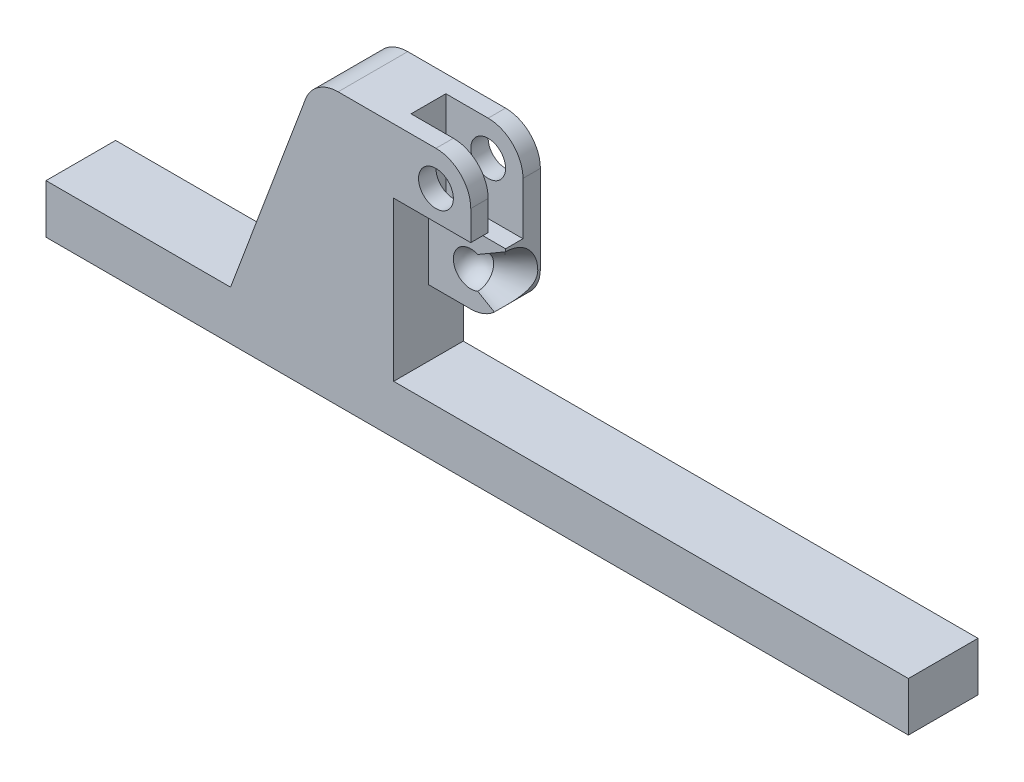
SolidWorks part; units mm, degrees
ref_plane "Plan1" through (0, 0, 0) normal (0, 0, 1) x (1, 0, 0)
ref_plane "Plan2" through (0, 0, 0) normal (0, 1, 0) x (1, 0, 0)
ref_plane "Plan3" through (0, 0, 0) normal (1, 0, 0) x (0, 0, -1)
sketch "Esquisse1" plane through (0, 0, 0) normal (0, 0, 1) x (1, 0, 0)
  line L0 (0, 35) -> (-28.1082, 35)
  line L1 (-37.4743, 28.5037) -> (-59.0068, -29.0567)
  line L2 (-112.0282, -43.1448) -> (135.7231, -43.1448)
  line L3 (135.7231, -43.1448) -> (135.7231, -29.0567)
  line L4 (135.7231, -29.0567) -> (-12.151, -29.0567)
  line L5 (-12.151, -29.0567) -> (-12.151, -10)
  line L6 (0, -10) -> (-12.151, -10)
  line L7 (10, 25) -> (10, 0)
  line L8 (-59.0068, -29.0567) -> (-112.0282, -29.0567)
  line L9 (-112.0282, -29.0567) -> (-112.0282, -43.1448)
  arc A1 (0, -10) -> (10, 0) centre (0, 0) ccw
  arc A2 (10, 25) -> (0, 35) centre (0, 25) ccw
  arc A3 (-37.4743, 28.5037) -> (-28.1082, 35) centre (-28.1082, 25) cw
  circle A4 centre (0, 25) radius 5
  dimension "D2" = 20
  dimension "D3" = 20
  dimension "D4" = 25
  dimension "D5" = 10
extrude "Base-Extrusion" add sketch "Esquisse1" along normal mid plane 20
sketch "Esquisse5" plane through (0, 0, 0) normal (0, 0, 1) x (1, 0, 0)
  line L0 (-9.2371, 0) -> (27.7395, 0) construction
  line L1 (2.0004, 4.5824) -> (12.8307, 10.9062)
  line L2 (12.8307, 10.9062) -> (12.8307, 0)
  line L3 (12.8307, 0) -> (-5, 0)
  arc A0 (2.0004, 4.5824) -> (-5, 0) centre (0, 0) ccw
  dimension "D1" = 10
revolve "Enlèvement de matière-Révolution2" cut sketch "Esquisse5" angle 360 about L0
sketch "Esquisse6" plane through (0, 0, 10) normal (0, 0, 1) x (1, 0, 0)
  line L1 (-12.151, -10) -> (12.9584, -10)
  line L2 (-12.151, -10) -> (-12.151, 16.5268)
  line L3 (-12.151, 16.5268) -> (12.9584, 16.5268)
  line L4 (12.9584, -10) -> (12.9584, 16.5268)
extrude "Enlèv. mat.-Extru.3" cut sketch "Esquisse6" against normal blind 10
sketch "Esquisse7" plane through (0, 35, 0) normal (0, 1, 0) x (-1, 0, 0)
  line L1 (-26.1164, -5) -> (12.151, -5)
  line L2 (-26.1164, -5) -> (-26.1164, 5)
  line L3 (-26.1164, 5) -> (12.151, 5)
  line L6 (12.151, -5) -> (12.151, 5)
  dimension "D1" = 10
  dimension "D2" = 5
extrude "Enlèv. mat.-Extru.4" cut sketch "Esquisse7" against normal blind 25
